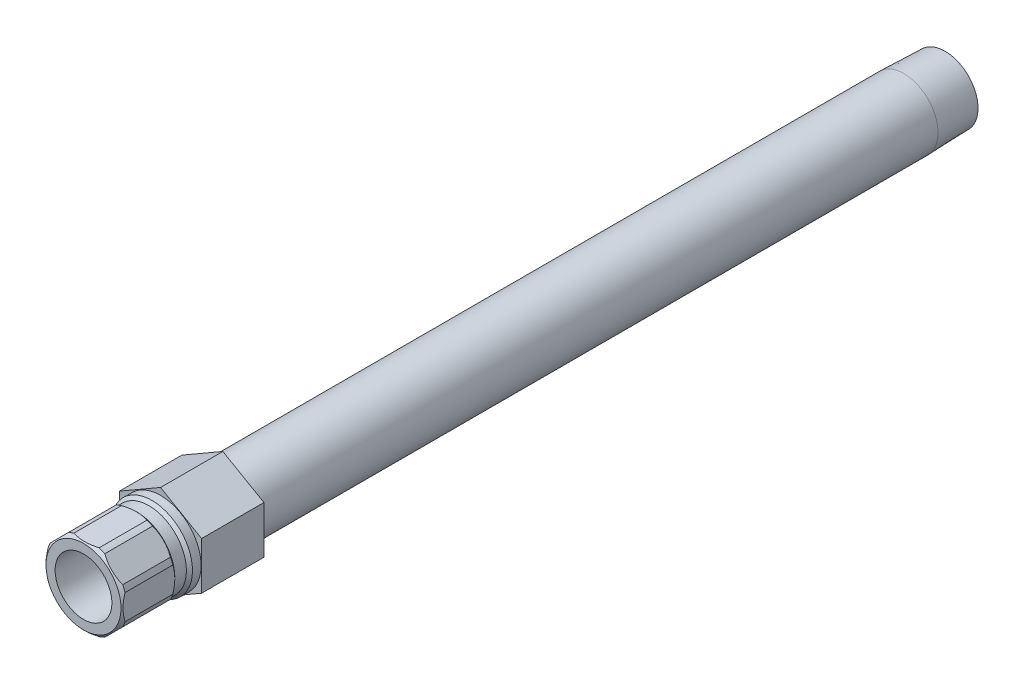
SolidWorks part; units mm, degrees
ref_plane "Front Plane" through (0, 0, 0) normal (0, 0, 1) x (1, 0, 0)
ref_plane "Top Plane" through (0, 0, 0) normal (0, 1, 0) x (1, 0, 0)
ref_plane "Right Plane" through (0, 0, 0) normal (1, 0, 0) x (0, 0, -1)
sketch "Sketch1" plane through (0, 0, 0) normal (1, 0, 0) x (0, 0, -1)
  line L0 (0, 0) -> (-22.479, 0) construction
  line L1 (-19.304, 7.112) -> (-19.304, 9.398)
  line L2 (-5.8166, 9.398) -> (-5.8166, 0) construction
  line L3 (-18.542, 10.16) -> (-6.5786, 10.16)
  line L4 (0, 8.5725) -> (0, 0) construction
  line L5 (-5.8166, 9.398) -> (-2.921, 9.398)
  line L6 (-2.159, 10.16) -> (0, 10.16)
  line L7 (0, 10.16) -> (0, 8.5725)
  line L8 (-5.8166, 9.398) -> (-6.5786, 10.16)
  line L9 (-2.921, 9.398) -> (-2.159, 10.16)
  line L10 (-19.304, 9.398) -> (-18.542, 10.16)
  line L11 (-19.304, 7.112) -> (-1.524, 7.112)
  line L12 (0, 8.5725) -> (186.2582, 8.5725)
  line L13 (186.2582, 8.5725) -> (196.596, 8.2494)
  line L14 (196.596, 8.2494) -> (196.596, 6.2611)
  line L15 (0, 10.16) -> (15.621, 10.16) construction
  line L16 (15.621, 10.16) -> (15.621, 7.112) construction
  line L17 (9.271, 0) -> (0, 0) construction
  line L18 (-1.524, 7.112) -> (-0.6731, 6.2611)
  line L19 (-0.6731, 6.2611) -> (196.596, 6.2611)
  dimension "D1" = 19.304
  dimension "D2" = 2.8956
  dimension "D3" = 0.762
  dimension "D4" = 45
  dimension "D5" = 13.4874
  dimension "D6" = 45
  dimension "D7" = 1.79
  dimension "D8" = 10.3378
  dimension "D9" = 215.9
  dimension "D10" = 3.175
  dimension "D11" = 34.925
  dimension "D12" = 14.224
  dimension "D13" = 17.145
  dimension "D14" = 20.32
  dimension "D15" = 12.5222
  dimension "D16" = 17.78
revolve "Revolve1" add sketch "Sketch1" angle 360 about L0
sketch "Sketch2" plane through (0, 0, 0) normal (0, 0, 1) x (1, 0, 0)
  line L1 (-10.287, 5.9392) -> (-10.287, -5.9392)
  line L2 (-10.287, -5.9392) -> (0, -11.8784)
  line L3 (0, -11.8784) -> (10.287, -5.9392)
  line L4 (10.287, -5.9392) -> (10.287, 5.9392)
  line L5 (10.287, 5.9392) -> (0, 11.8784)
  line L6 (0, 11.8784) -> (-10.287, 5.9392)
  circle A0 centre (0, 0) radius 10.287 construction
  circle A1 centre (0, 0) radius 6.2611 construction
  circle A2 centre (0, 0) radius 6.2611
  dimension "D1" = 20.574
extrude "Boss-Extrude1" add sketch "Sketch2" against normal up to vertex (15.621 mm away) from vertex at 0
sketch "Sketch3" plane through (0, 0, 0) normal (0, 0, 1) x (1, 0, 0)
  line L1 (9.652, -3.998) -> (9.652, 3.998)
  line L2 (9.652, 3.998) -> (3.998, 9.652)
  line L3 (3.998, 9.652) -> (-3.998, 9.652)
  line L4 (-3.998, 9.652) -> (-9.652, 3.998)
  line L5 (-9.652, 3.998) -> (-9.652, -3.998)
  line L6 (-9.652, -3.998) -> (-3.998, -9.652)
  line L7 (-3.998, -9.652) -> (3.998, -9.652)
  line L8 (3.998, -9.652) -> (9.652, -3.998)
  circle A0 centre (0, 0) radius 9.652 construction
  dimension "D1" = 19.304
extrude "Cut-Extrude1" cut sketch "Sketch3" along normal through all from vertex at 5.8166 flip side to cut
